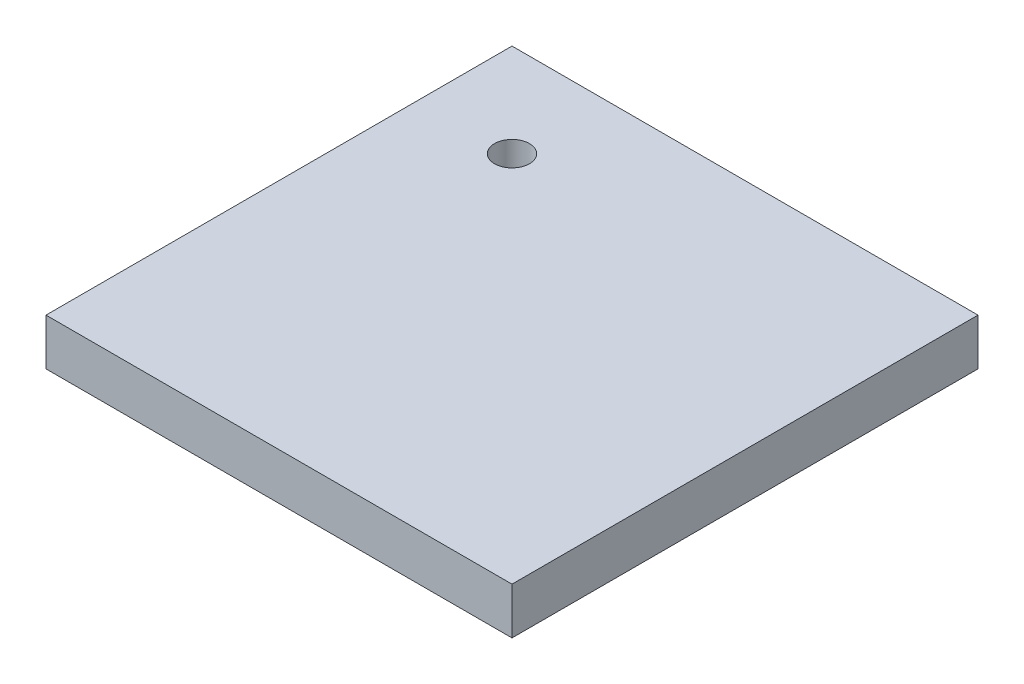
SolidWorks part; units mm, degrees
ref_plane "Front Plane" through (0, 0, 0) normal (0, 0, 1) x (1, 0, 0)
ref_plane "Top Plane" through (0, 0, 0) normal (0, 1, 0) x (1, 0, 0)
ref_plane "Right Plane" through (0, 0, 0) normal (1, 0, 0) x (0, 0, -1)
sketch "Sketch1" plane through (0, 0, 0) normal (0, 1, 0) x (1, 0, 0)
  line L1 (0, 0) -> (100, 0)
  line L2 (0, 0) -> (0, 100)
  line L3 (0, 100) -> (100, 100)
  line L4 (100, 0) -> (100, 100)
  dimension "D1" = 100
  dimension "D2" = 100
extrude "Extrude1" add sketch "Sketch1" along normal blind 10
hole_wizard "Ø7.5 (7.5) Diameter Hole1" positions "3DSketch1" profile "Sketch2" hole size "Ø7.5" standard "ANSI Metric"
sketch3d "3DSketch1"
  line L0 (0, 10, -100) -> (0, 10, 0) construction
  line L1 (100, 10, -100) -> (0, 10, -100) construction
  point P0 (20, 10, -80)
  dimension "D1" = 20
  dimension "D2" = 20
sketch "Sketch2" plane through (20, 10, -80) normal (1, 0, 0) x (0, 0, 1)
  line L0 (0, 0) -> (0, 12.2532)
  line L1 (0, 12.2532) -> (3.75, 10)
  line L2 (3.75, 10) -> (3.75, 0)
  line L5 (3.75, 0) -> (0, 0)
  line L10 (0, 12.2532) -> (-3.75, 10) construction
  line L11 (0, -6.35) -> (0, 107.95) construction
  dimension "Hole Dia." = 7.5
  dimension "Hole Depth" = 10
  dimension "Drill Angle" = 118
